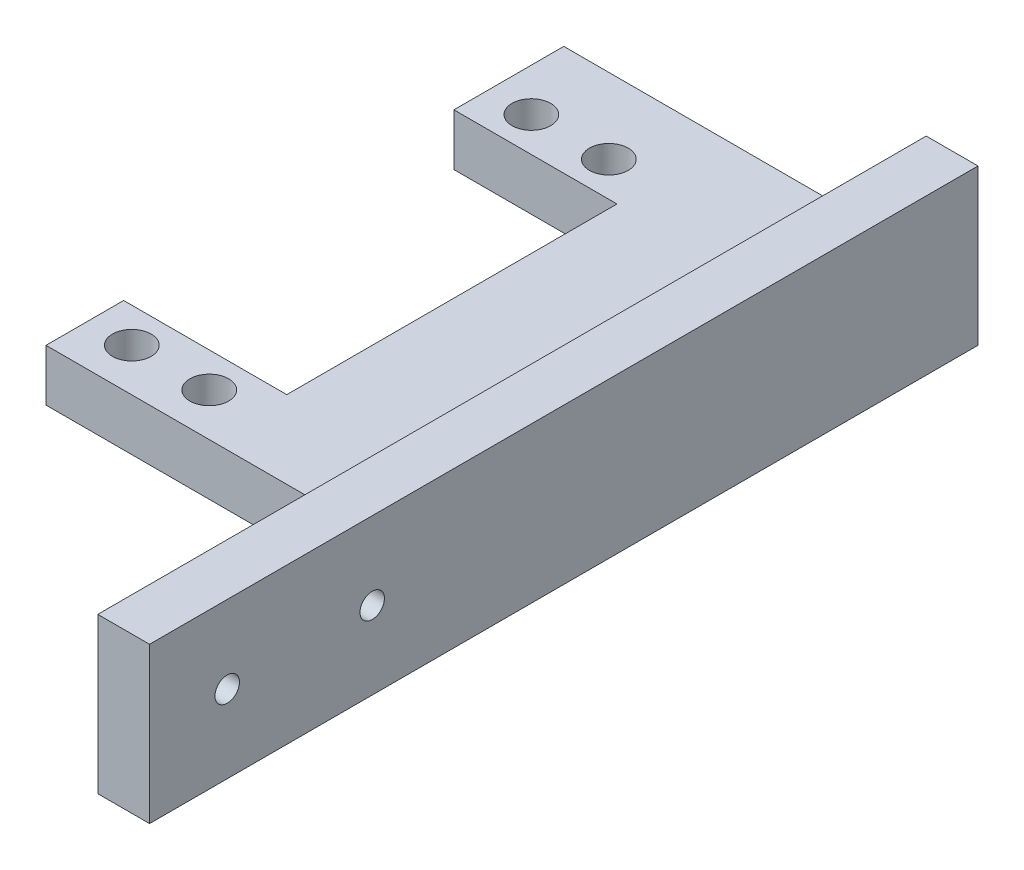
SolidWorks part; units mm, degrees
ref_plane "Front Plane" through (0, 0, 0) normal (0, 0, 1) x (1, 0, 0)
ref_plane "Top Plane" through (0, 0, 0) normal (0, 1, 0) x (1, 0, 0)
ref_plane "Right Plane" through (0, 0, 0) normal (1, 0, 0) x (0, 0, -1)
sketch "Sketch1" plane through (0, 0, 0) normal (1, 0, 0) x (0, 0, -1)
  line L1 (92.075, 9.525) -> (-9.525, 9.525)
  line L2 (92.075, 9.525) -> (92.075, -9.525)
  line L3 (92.075, -9.525) -> (-9.525, -9.525)
  line L4 (-9.525, 9.525) -> (-9.525, -9.525)
  line L5 (92.075, 9.525) -> (-9.525, -9.525) construction
  line L6 (92.075, -9.525) -> (-9.525, 9.525) construction
  circle A0 centre (0, 0) radius 1.5
  circle A1 centre (17.78, 0) radius 1.5
  point P5 (41.275, 0)
  dimension "D2" = 3
  dimension "D3" = 3
  dimension "D1" = 17.78
  dimension "D4" = 101.6
  dimension "D5" = 19.05
  dimension "D6" = 9.525
extrude "Boss-Extrude1" add sketch "Sketch1" along normal blind 6.35
sketch "Sketch2" plane through (6.35, 0, 0) normal (1, 0, 0) x (0, 0, -1)
  line L1 (92.075, -9.525) -> (28.575, -9.525)
  line L2 (92.075, -9.525) -> (92.075, -3.175)
  line L3 (92.075, -3.175) -> (28.575, -3.175)
  line L4 (28.575, -9.525) -> (28.575, -3.175)
  dimension "D1" = 6.35
  dimension "D2" = 63.5
extrude "Boss-Extrude2" add sketch "Sketch2" against normal blind 50.8
sketch "Sketch3" plane through (0, -3.175, 0) normal (0, 1, 0) x (1, 0, 0)
  line L0 (-44.45, 92.075) -> (-44.45, 28.575) construction
  line L5 (-44.45, 58.35) -> (-24.45, 58.35) construction
  line L6 (-34.45, 58.35) -> (-34.45, 38.1) construction
  line L7 (-44.45, 78.6) -> (-24.45, 78.6)
  line L8 (-44.45, 78.6) -> (-44.45, 38.1)
  line L9 (-44.45, 38.1) -> (-24.45, 38.1)
  line L10 (-24.45, 78.6) -> (-24.45, 38.1)
  line L11 (-44.45, 28.575) -> (0, 28.575) construction
  circle A0 centre (-39.2, 33.85) radius 2.375
  circle A1 centre (-29.7, 33.85) radius 2.375
  circle A2 centre (-29.7, 82.85) radius 2.375
  circle A3 centre (-39.2, 82.85) radius 2.375
  dimension "D6" = 4.75
  dimension "D1" = 40.5
  dimension "D2" = 20
  dimension "D3" = 9.525
  dimension "D4" = 24.5
  dimension "D5" = 4.75
extrude "Cut-Extrude1" cut sketch "Sketch3" against normal through all
